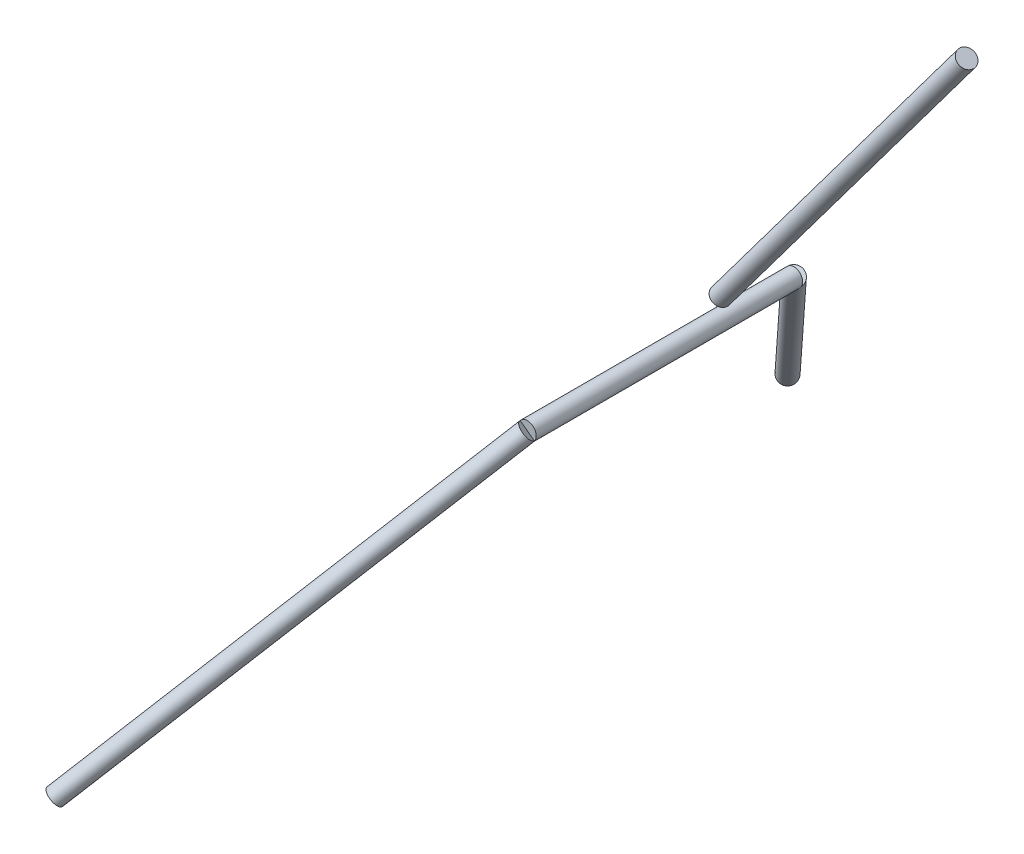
SolidWorks part; units mm, degrees
ref_plane "Alzado" through (0, 0, 0) normal (0, 0, 1) x (1, 0, 0)
ref_plane "Planta" through (0, 0, 0) normal (0, 1, 0) x (1, 0, 0)
ref_plane "Vista lateral" through (0, 0, 0) normal (1, 0, 0) x (0, 0, -1)
sketch3d "Sk_Cable_puente_1"
  line L0 (-219.3921, 374.9527, -33) -> (-197.8236, 403.7762, -12)
  dimension "D1" = 41.6773
sweep "Cable_puente_1" add path "Sk_Cable_puente_1" parameters "D3"=1.6
sketch3d "Sk_Cable_puente_2"
  line L0 (-197.8236, 403.7762, -12) -> (-197.8236, 403.7762, 12)
sweep "Cable_puente_2" add path "Sk_Cable_puente_2" parameters "D3"=1.6
sketch3d "Sk_Cable_puente_3"
  line L0 (-197.8236, 403.7762, 12) -> (-219.3921, 374.9527, 33)
  dimension "D1" = 41.6773
sweep "Cable_puente_3" add path "Sk_Cable_puente_3" parameters "D3"=1.6
sketch3d "Sk_Cable_tiro"
  line L0 (-192.4314, 410.9821, 0) -> (-170.2637, 440.6063, 0)
  dimension "D1" = 37
sweep "Cable_tiro" add path "Sk_Cable_tiro" parameters "D3"=1.6
